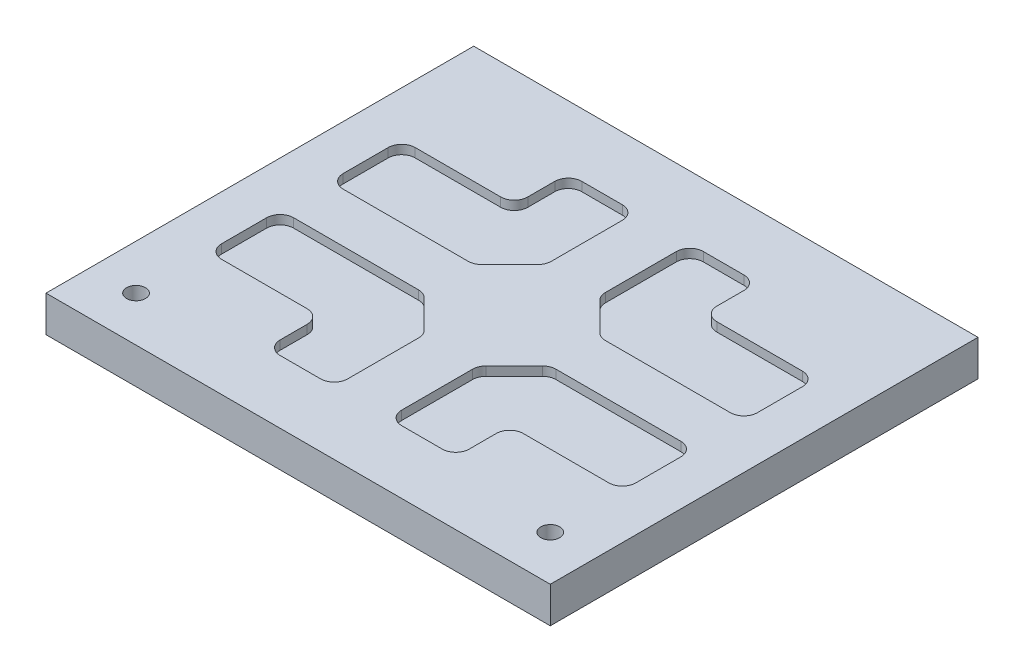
SolidWorks part; units mm, degrees
ref_plane "Front" through (0, 0, 0) normal (0, 0, 1) x (1, 0, 0)
ref_plane "Top" through (0, 0, 0) normal (0, 1, 0) x (1, 0, 0)
ref_plane "Right" through (0, 0, 0) normal (1, 0, 0) x (0, 0, -1)
sketch "Sketch1" plane through (0, 0, 0) normal (0, 1, 0) x (1, 0, 0)
  line L1 (-280, -237.5) -> (280, -237.5)
  line L2 (-280, -237.5) -> (-280, 237.5)
  line L3 (-280, 237.5) -> (280, 237.5)
  line L4 (280, -237.5) -> (280, 237.5)
  line L5 (-280, -237.5) -> (280, 237.5) construction
  line L6 (-280, 237.5) -> (280, -237.5) construction
  point P0 (0, 0)
  dimension "D1" = 560
  dimension "D2" = 475
extrude "Boss-Extrude1" add sketch "Sketch1" along normal blind 40
sketch "Sketch7" plane through (0, 40, 0) normal (0, 1, 0) x (1, 0, 0)
  line L0 (0, 237.5) -> (0, -237.5) construction
  line L1 (280, 237.5) -> (-280, 237.5) construction
  line L2 (-280, -237.5) -> (280, -237.5) construction
  line L3 (-280, 0) -> (280, 0) construction
  line L4 (-280, 237.5) -> (-280, -237.5) construction
  line L5 (280, -237.5) -> (280, 237.5) construction
  line L6 (-30, -152.5) -> (-30, -73.7132)
  line L7 (-34.3934, -63.1066) -> (-65.6066, -31.8934)
  line L8 (-76.2132, -27.5) -> (-215, -27.5)
  line L9 (-230, -42.5) -> (-230, -92.5)
  line L10 (-215, -107.5) -> (-120, -107.5)
  line L11 (-105, -122.5) -> (-105, -152.5)
  line L12 (-90, -167.5) -> (-45, -167.5)
  line L13 (-105, 122.5) -> (-105, 152.5)
  line L14 (-215, 107.5) -> (-120, 107.5)
  line L15 (-230, 42.5) -> (-230, 92.5)
  line L16 (-76.2132, 27.5) -> (-215, 27.5)
  line L17 (-34.3934, 63.1066) -> (-65.6066, 31.8934)
  line L18 (-30, 152.5) -> (-30, 73.7132)
  line L19 (-90, 167.5) -> (-45, 167.5)
  line L20 (215, 107.5) -> (120, 107.5)
  line L21 (230, 42.5) -> (230, 92.5)
  line L22 (76.2132, 27.5) -> (215, 27.5)
  line L23 (34.3934, 63.1066) -> (65.6066, 31.8934)
  line L24 (30, 152.5) -> (30, 73.7132)
  line L25 (90, 167.5) -> (45, 167.5)
  line L26 (105, 122.5) -> (105, 152.5)
  line L27 (105, -122.5) -> (105, -152.5)
  line L28 (215, -107.5) -> (120, -107.5)
  line L29 (230, -42.5) -> (230, -92.5)
  line L30 (76.2132, -27.5) -> (215, -27.5)
  line L31 (34.3934, -63.1066) -> (65.6066, -31.8934)
  line L32 (30, -152.5) -> (30, -73.7132)
  line L33 (90, -167.5) -> (45, -167.5)
  arc A0 (-120, -107.5) -> (-105, -122.5) centre (-120, -122.5) cw
  arc A1 (-105, -152.5) -> (-90, -167.5) centre (-90, -152.5) ccw
  arc A2 (-30, -152.5) -> (-45, -167.5) centre (-45, -152.5) cw
  arc A3 (-30, -73.7132) -> (-34.3934, -63.1066) centre (-45, -73.7132) ccw
  arc A4 (-65.6066, -31.8934) -> (-76.2132, -27.5) centre (-76.2132, -42.5) ccw
  arc A5 (-215, -27.5) -> (-230, -42.5) centre (-215, -42.5) ccw
  arc A6 (-230, -92.5) -> (-215, -107.5) centre (-215, -92.5) ccw
  arc A7 (-120, 107.5) -> (-105, 122.5) centre (-120, 122.5) ccw
  arc A8 (-230, 92.5) -> (-215, 107.5) centre (-215, 92.5) cw
  arc A9 (-215, 27.5) -> (-230, 42.5) centre (-215, 42.5) cw
  arc A10 (-65.6066, 31.8934) -> (-76.2132, 27.5) centre (-76.2132, 42.5) cw
  arc A11 (-30, 73.7132) -> (-34.3934, 63.1066) centre (-45, 73.7132) cw
  arc A12 (-105, 152.5) -> (-90, 167.5) centre (-90, 152.5) cw
  arc A13 (-30, 152.5) -> (-45, 167.5) centre (-45, 152.5) ccw
  arc A14 (120, 107.5) -> (105, 122.5) centre (120, 122.5) cw
  arc A15 (230, 92.5) -> (215, 107.5) centre (215, 92.5) ccw
  arc A16 (215, 27.5) -> (230, 42.5) centre (215, 42.5) ccw
  arc A17 (65.6066, 31.8934) -> (76.2132, 27.5) centre (76.2132, 42.5) ccw
  arc A18 (30, 73.7132) -> (34.3934, 63.1066) centre (45, 73.7132) ccw
  arc A19 (30, 152.5) -> (45, 167.5) centre (45, 152.5) cw
  arc A20 (105, 152.5) -> (90, 167.5) centre (90, 152.5) ccw
  arc A21 (120, -107.5) -> (105, -122.5) centre (120, -122.5) ccw
  arc A22 (230, -92.5) -> (215, -107.5) centre (215, -92.5) cw
  arc A23 (215, -27.5) -> (230, -42.5) centre (215, -42.5) cw
  arc A24 (65.6066, -31.8934) -> (76.2132, -27.5) centre (76.2132, -42.5) cw
  arc A25 (30, -73.7132) -> (34.3934, -63.1066) centre (45, -73.7132) cw
  arc A26 (105, -152.5) -> (90, -167.5) centre (90, -152.5) cw
  arc A27 (30, -152.5) -> (45, -167.5) centre (45, -152.5) ccw
  point P21 (-105, -107.5)
  point P24 (-105, -167.5)
  point P27 (-30, -167.5)
  point P30 (-30, -67.5)
  point P35 (-230, -27.5)
  point P38 (-230, -107.5)
  dimension "D9" = 15
  dimension "D1" = 30
  dimension "D2" = 50
  dimension "D3" = 75
  dimension "D4" = 80
  dimension "D5" = 210
  dimension "D6" = 60
  dimension "D7" = 135
  dimension "D8" = 100
extrude "Cut-Extrude1" cut sketch "Sketch7" against normal blind 10
hole_wizard "M24x3.0 Tapped Hole1" positions "Sketch10" profile "Sketch11" tap size "M24x3.0" standard "ANSI Metric"
sketch "Sketch10" plane through (0, 40, 0) normal (0, 1, 0) x (1, 0, 0)
  line L0 (-280, 237.5) -> (-280, -237.5) construction
  line L1 (-280, -237.5) -> (280, -237.5) construction
  line L2 (280, -237.5) -> (280, 237.5) construction
  point P0 (-230, -187.5)
  point P2 (230, -187.5)
  dimension "D1" = 50
  dimension "D2" = 50
  dimension "D3" = 50
  dimension "D4" = 50
sketch "Sketch11" plane through (-230, 40, 187.5) normal (1, 0, 0) x (0, 0, 1)
  line L0 (0, 0) -> (0, 40)
  line L1 (0, 40) -> (10.5, 40)
  line L2 (10.5, 40) -> (10.5, 0)
  line L5 (10.5, 0) -> (0, 0)
  line L11 (0, -6.35) -> (0, 107.95) construction
  dimension "Thru Tap Drill Dia." = 21
  dimension "Thru Tap Drill Depth" = 40
